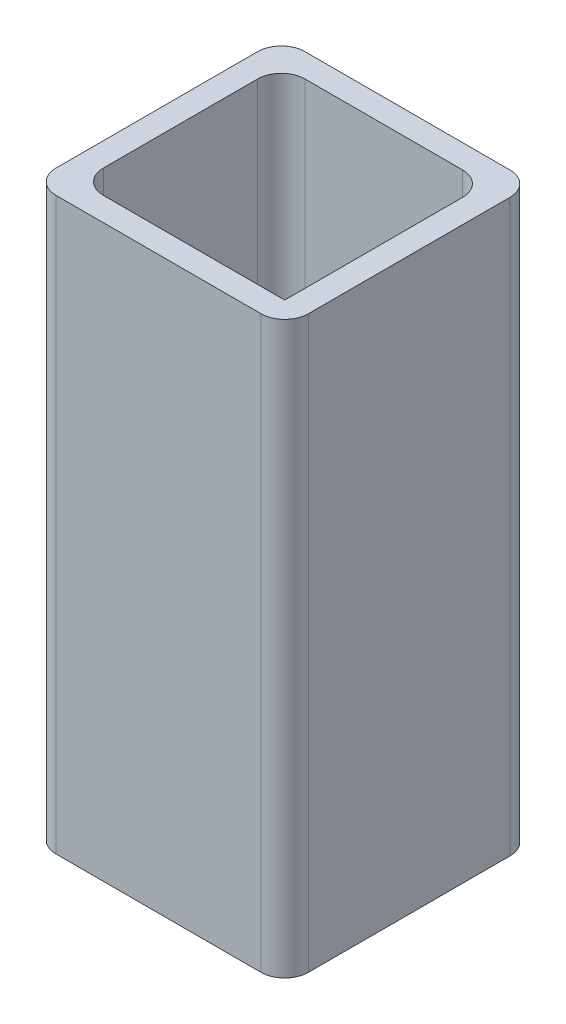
SolidWorks part; units mm, degrees
ref_plane "Alzado" through (0, 0, 0) normal (0, 0, 1) x (1, 0, 0)
ref_plane "Planta" through (0, 0, 0) normal (0, 1, 0) x (1, 0, 0)
ref_plane "Vista lateral" through (0, 0, 0) normal (1, 0, 0) x (0, 0, -1)
sketch "Croquis1" plane through (0, 0, 0) normal (0, 1, 0) x (1, 0, 0)
  line L0 (-43.3085, 42.5966) -> (43.3085, -42.5966) construction
  line L1 (-43.3085, 42.5966) -> (43.3085, 42.5966)
  line L2 (-43.3085, 42.5966) -> (-43.3085, -42.5966)
  line L3 (-43.3085, -42.5966) -> (43.3085, -42.5966)
  line L4 (43.3085, 42.5966) -> (43.3085, -42.5966)
  line L5 (-53.3085, 52.5966) -> (53.3085, 52.5966)
  line L6 (53.3085, 52.5966) -> (53.3085, -52.5966)
  line L7 (-53.3085, -52.5966) -> (53.3085, -52.5966)
  line L8 (-53.3085, 52.5966) -> (-53.3085, -52.5966)
  dimension "D1" = 10
extrude "Saliente-Extruir1" add sketch "Croquis1" along normal blind 241
fillet "Redondeo1" radius 10 7 edges at (-53.3085, 120.5, -52.5966) (53.3085, 120.5, -52.5966) (43.3085, 120.5, -42.5966) (-43.3085, 120.5, 42.5966) (-53.3085, 120.5, 52.5966) (-43.3085, 120.5, -42.5966) (53.3085, 120.5, 52.5966)
